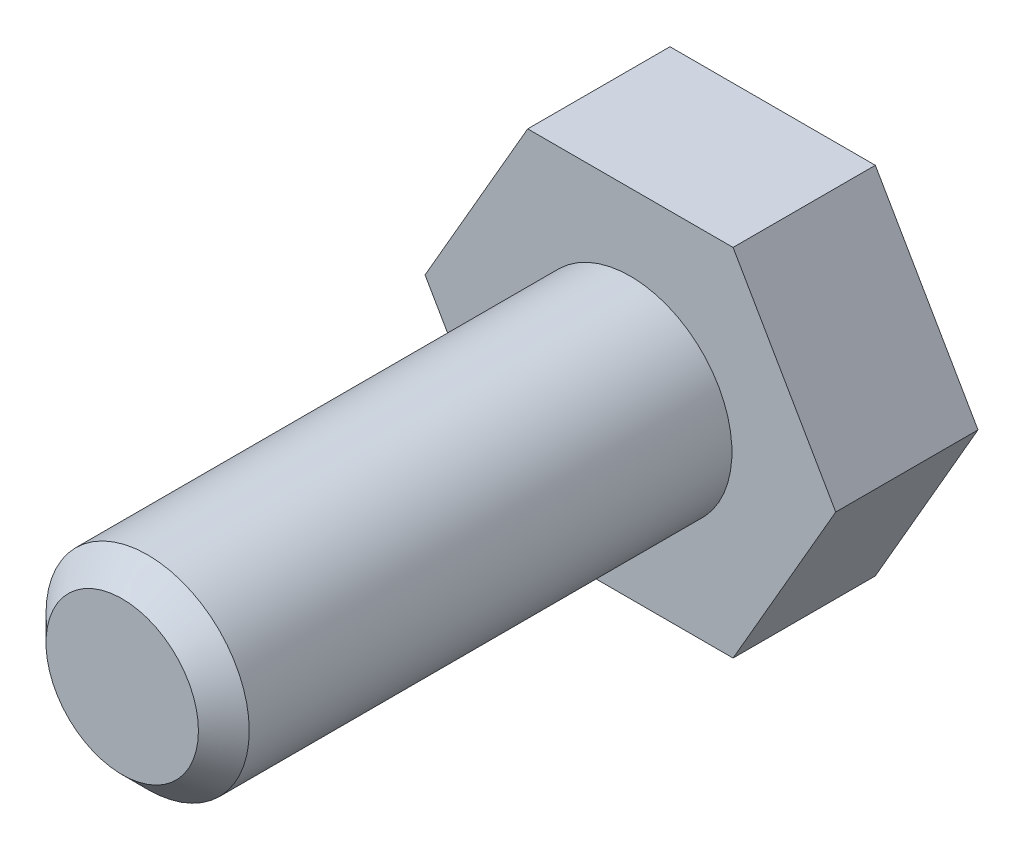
SolidWorks part; units mm, degrees
ref_plane "Plan de face" through (0, 0, 0) normal (0, 0, 1) x (1, 0, 0)
ref_plane "Plan de dessus" through (0, 0, 0) normal (0, 1, 0) x (1, 0, 0)
ref_plane "Plan de droite" through (0, 0, 0) normal (1, 0, 0) x (0, 0, -1)
sketch "Esquisse1" plane through (0, 0, 0) normal (0, 0, 1) x (1, 0, 0)
  line L0 (-2.0193, -3.5) -> (-4.04, 0)
  line L1 (-4.04, 0) -> (-2.0193, 3.5)
  line L2 (-2.0193, -3.5) -> (2.0222, -3.5)
  line L3 (-2.0193, 3.5) -> (2.0222, 3.5)
  line L4 (2.0222, 3.5) -> (4.0429, 0)
  line L5 (4.0429, 0) -> (2.0222, -3.5)
  dimension "D1" = 7
  dimension "D2" = 7
  dimension "D3" = 7
  dimension "D4" = 4.04
extrude "Boss.-Extru.1" add sketch "Esquisse1" along normal blind 2.8
sketch "Esquisse3" plane through (0, 0, 2.8) normal (0, 0, 1) x (1, 0, 0)
  circle A0 centre (0, 0) radius 2
  dimension "D1" = 4
extrude "Boss.-Extru.2" add sketch "Esquisse3" along normal blind 10
chamfer "Chanfrein1" distance 0.5 angle 45 1 edges at (2, 0, 12.8)
